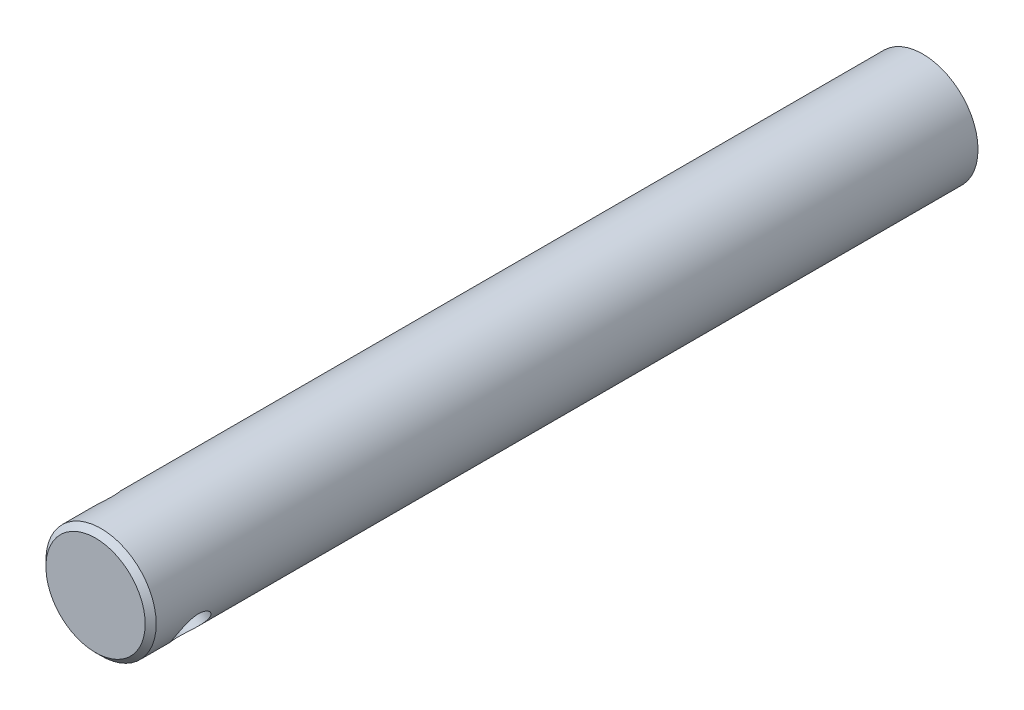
SolidWorks part; units mm, degrees
ref_plane "Front Plane" through (0, 0, 0) normal (0, 0, 1) x (1, 0, 0)
ref_plane "Top Plane" through (0, 0, 0) normal (0, 1, 0) x (1, 0, 0)
ref_plane "Right Plane" through (0, 0, 0) normal (1, 0, 0) x (0, 0, -1)
sketch "Sketch1" plane through (0, 0, 0) normal (0, 0, 1) x (1, 0, 0)
  circle A0 centre (0, 0) radius 10
  dimension "D1" = 20
extrude "Boss-Extrude1" add sketch "Sketch1" along normal blind 150
sketch "Sketch2" plane through (-16.4085, 10.9957, 0) normal (-0.8307, 0.5567, 0) x (0, 0, -1)
  line L0 (-150, 0) -> (0, 0) construction
  line L1 (-150, 10) -> (-150, -10) construction
  circle A1 centre (-141, 0) radius 3.25
  dimension "D1" = 9
  dimension "D2" = 6.5
extrude "Cut-Extrude1" cut sketch "Sketch2" against normal through all contours A1 L0 | L0 A1
chamfer "Chamfer1" distance 1 angle 45 1 edges at (10, 0, 150)
